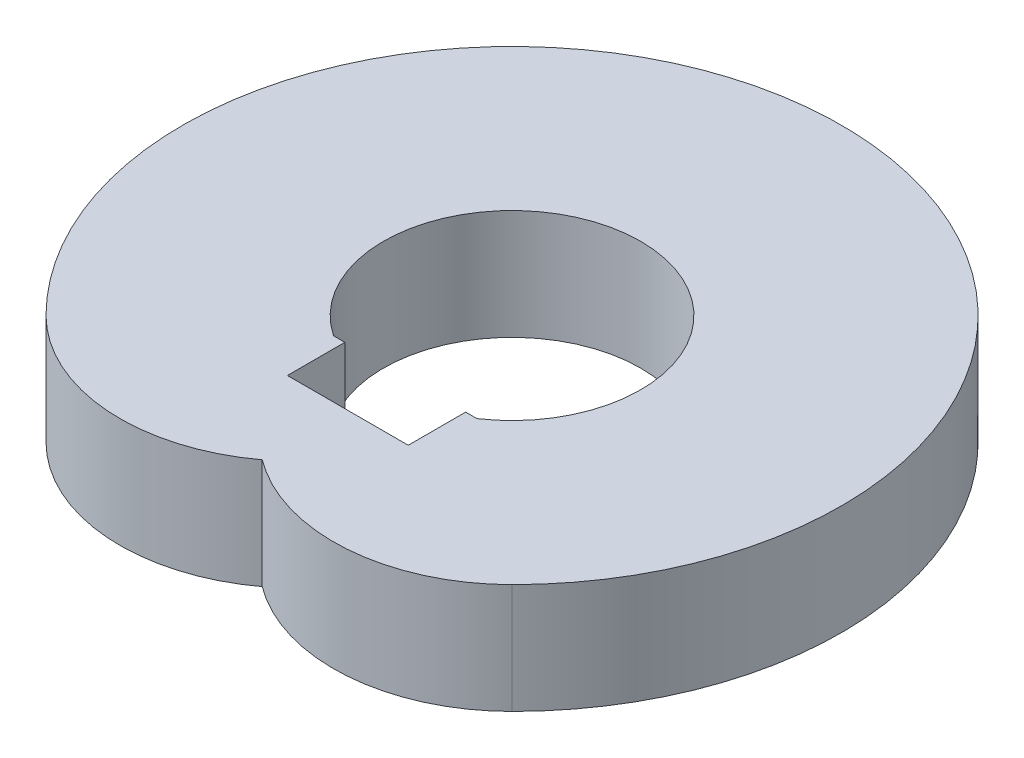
SolidWorks part; units mm, degrees
ref_plane "前视基准面" through (0, 0, 0) normal (0, 0, 1) x (1, 0, 0)
ref_plane "上视基准面" through (0, 0, 0) normal (0, 1, 0) x (1, 0, 0)
ref_plane "右视基准面" through (0, 0, 0) normal (1, 0, 0) x (0, 0, -1)
sketch "草图1" plane through (0, 0, 0) normal (0, 1, 0) x (1, 0, 0)
  line L0 (0, 0) -> (0, 825) construction
  line L1 (0, 0) -> (-424.2641, -424.2641) construction
  line L2 (0, 0) -> (424.2641, -424.2641) construction
  line L3 (0, 275) -> (229.8097, 45.1903) construction
  line L4 (0, 275) -> (-229.8097, 45.1903) construction
  line L5 (-110, -194.4544) -> (-110, -299)
  line L6 (130.5456, -194.4544) -> (110, -194.4544)
  line L7 (-110, -299) -> (110, -299)
  line L8 (110, -194.4544) -> (110, -299)
  line L9 (-110, -194.4544) -> (-130.5456, -194.4544)
  circle A0 centre (0, 0) radius 275 construction
  circle A1 centre (0, 275) radius 325 construction
  arc A2 (424.2641, -424.2641) -> (-424.2641, -424.2641) centre (0, 0) ccw
  arc A4 (-424.2641, -424.2641) -> (0, -454.8627) centre (-194.4544, -194.4544) ccw
  arc A5 (0, -454.8627) -> (424.2641, -424.2641) centre (194.4544, -194.4544) ccw
  arc A7 (130.5456, -194.4544) -> (-130.5456, -194.4544) centre (0, 0) ccw
  point P19 (0, -299)
  dimension "D1" = 550
  dimension "D2" = 650
  dimension "D4" = 135
  dimension "D3" = 600
  dimension "D8" = 299
  dimension "D5" = 135
  dimension "D6" = 135
  dimension "D7" = 135
  dimension "D9" = 220
extrude "凸台-拉伸1" add sketch "草图1" along normal blind 200
